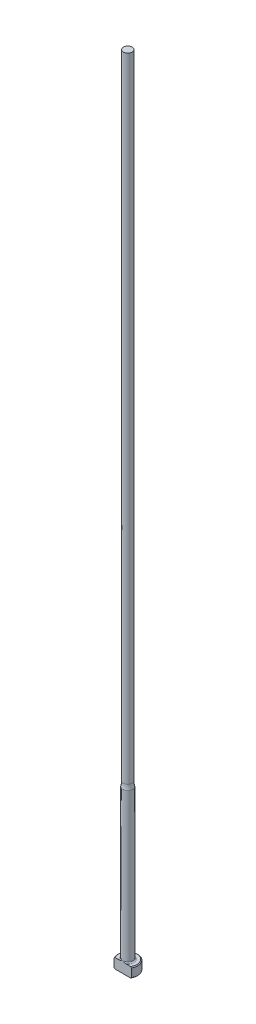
SolidWorks part; units mm, degrees
ref_plane "Front Plane" through (0, 0, 0) normal (0, 0, 1) x (1, 0, 0)
ref_plane "Top Plane" through (0, 0, 0) normal (0, 1, 0) x (1, 0, 0)
ref_plane "Right Plane" through (0, 0, 0) normal (1, 0, 0) x (0, 0, -1)
sketch "Sketch1" plane through (0, 0, 0) normal (0, 0, 1) x (1, 0, 0)
  line L0 (0, 259.9588) -> (0, -15.1925) construction
  line L1 (0, 0) -> (-3.175, 0)
  line L2 (-3.175, 0) -> (-3.175, 3.175)
  line L3 (-3.175, 3.175) -> (-1.5875, 3.175)
  line L4 (-1.3881, 52.3788) -> (-1.3881, 254)
  line L5 (-1.3881, 254) -> (0, 254)
  line L6 (0, 254) -> (0, 0)
  line L7 (-1.5875, 3.175) -> (-1.5875, 50.8)
  arc A0 (-1.5875, 50.8) -> (-1.3881, 52.3788) centre (-7.7381, 52.3788) ccw
  point P13 (-1.5875, 0)
  dimension "D1" = 6.35
  dimension "L" = 254
  dimension "D2" = 3.175
  dimension "H" = 6.35
  dimension "T" = 3.175
  dimension "D" = 2.7762
  dimension "S" = 50.8
revolve "Revolve1" add sketch "Sketch1" angle 360 about L0
chamfer "Chamfer1" distance 0.254 angle 45 2 edges at (0, 3.175, 3.175) (0, 0, 3.175)
fillet "Fillet1" radius 0.381 1 edges at (0, 3.175, 1.5875)
sketch "Sketch2" plane through (0, 0, 0) normal (0, -1, 0) x (1, 0, 0)
  line L0 (-2.7496, 1.5875) -> (2.7496, 1.5875)
  circle A0 centre (0, 0) radius 3.175 construction
  arc A1 (2.7496, 1.5875) -> (-2.7496, 1.5875) centre (0, 0) ccw
  circle A4 centre (0, 0) radius 1.5875 construction
  dimension "D1" = 0
extrude "KEY" cut sketch "Sketch2" against normal through all
